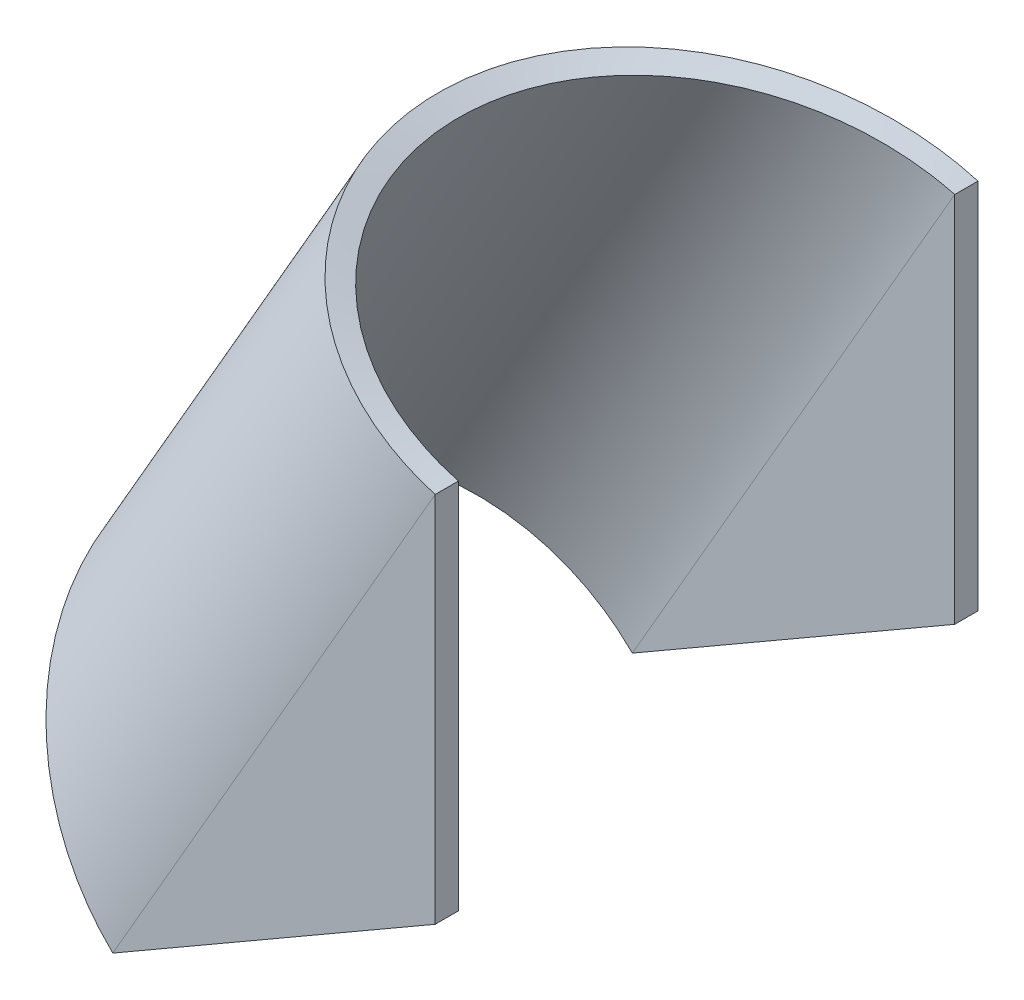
SolidWorks part; units mm, degrees
ref_plane "前视基准面" through (0, 0, 0) normal (0, 0, 1) x (1, 0, 0)
ref_plane "上视基准面" through (0, 0, 0) normal (0, 1, 0) x (1, 0, 0)
ref_plane "右视基准面" through (0, 0, 0) normal (1, 0, 0) x (0, 0, -1)
imported_body "基体零件-带补料的120°Y形三通管-1"
sheet metal parameters "钣金1" parameters "D1"=0.7366, "厚度"=1
bend "圆角折弯1" bend radius 10.6658 bend angle 180 parameters "D5"=1
flatten bends "展开-折弯1" parameters "D1"=0
sketch "尖角-草图1" plane through (0, 0, -10.6658) normal (0, 0, 1) x (1, 0, 0)
  line L0 (-14.5093, 24.3769) -> (-28.3657, 0.3769) construction
process bends "加工-折弯1" parameters "D1"=0
sketch "平面-草图1" plane through (0, 0, -10.6658) normal (0, 0, 1) x (1, 0, 0)
flat pattern "平板型式1"
sketch "折弯-线1" plane through (0, 0, 0) normal (0, 1, 0) x (-1, 0, 0)
bend of the flat pattern "展开-<圆角折弯1>1"
